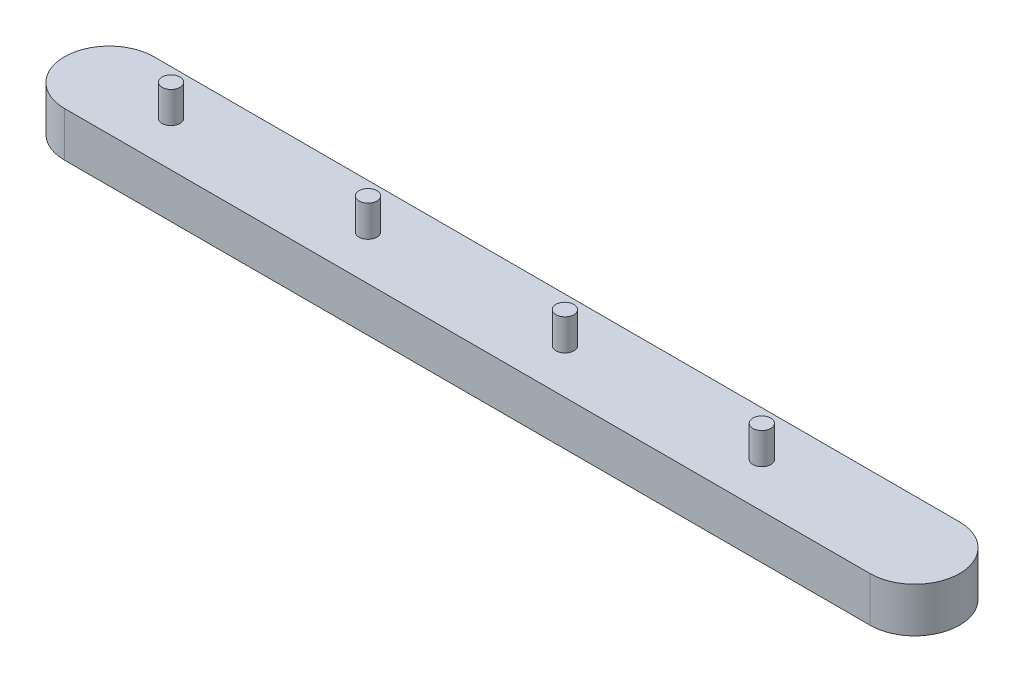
SolidWorks part; units mm, degrees
ref_plane "Front Plane" through (0, 0, 0) normal (0, 0, 1) x (1, 0, 0)
ref_plane "Top Plane" through (0, 0, 0) normal (0, 1, 0) x (1, 0, 0)
ref_plane "Right Plane" through (0, 0, 0) normal (1, 0, 0) x (0, 0, -1)
sketch "Sketch1" plane through (0, 0, 0) normal (0, 1, 0) x (1, 0, 0)
  line L0 (-1056, 0) -> (744, 0) construction
  line L1 (-1056, 100) -> (744, 100)
  line L2 (-1056, -100) -> (744, -100)
  arc A0 (-1056, 100) -> (-1056, -100) centre (-1056, 0) ccw
  arc A1 (744, -100) -> (744, 100) centre (744, 0) ccw
  point P3 (-156, 0)
  dimension "D1" = 200
extrude "Boss-Extrude1" add sketch "Sketch1" along normal blind 100
ref_plane "Plane1" through (0, 100, 0) normal (0, 1, 0) x (1, 0, 0)
sketch "Sketch2" plane through (0, 100, 0) normal (0, 1, 0) x (1, 0, 0)
  line L0 (1330.1892, 0) -> (-1720.0584, 0) construction
  circle A0 centre (-917.7543, 0) radius 20
  circle A1 centre (-477.7543, 0) radius 20
  circle A2 centre (-37.7543, 0) radius 20
  circle A3 centre (402.2457, 0) radius 20
  dimension "D1" = 40
  dimension "D2" = 4
extrude "Boss-Extrude2" add sketch "Sketch2" along normal blind 70
